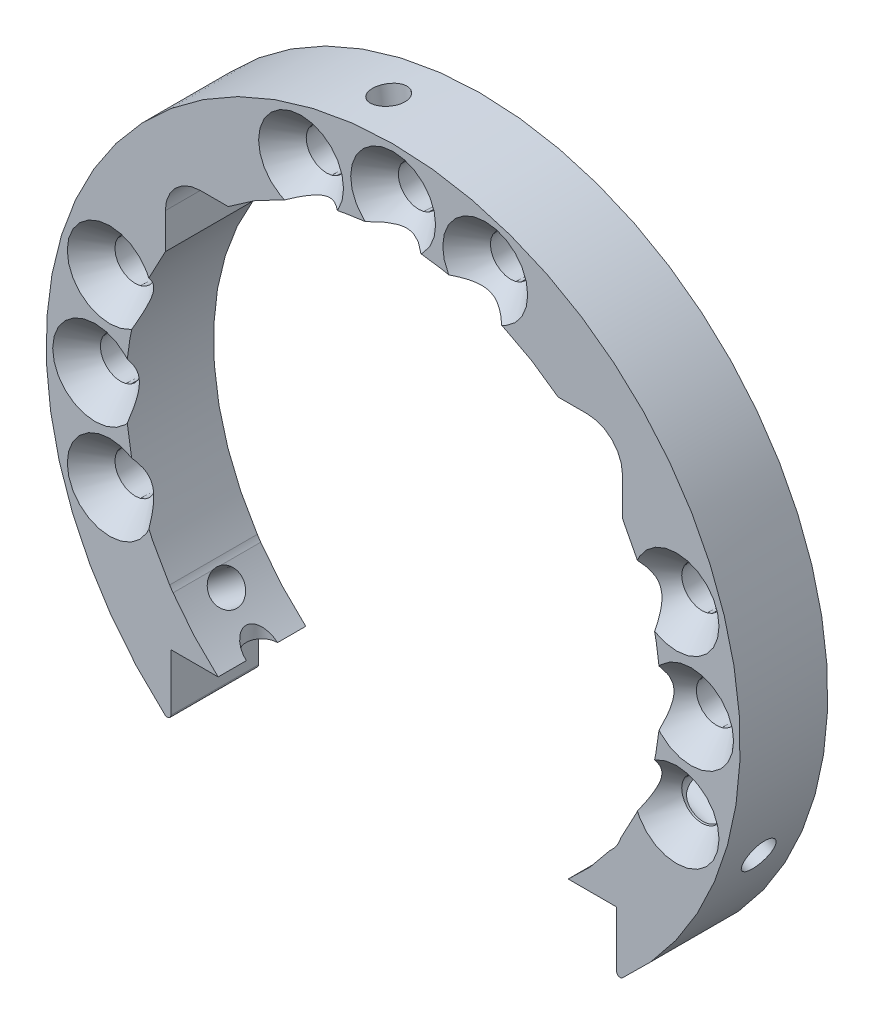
SolidWorks part; units mm, degrees
ref_plane "Front Plane" through (0, 0, 0) normal (0, 0, 1) x (1, 0, 0)
ref_plane "Top Plane" through (0, 0, 0) normal (0, 1, 0) x (1, 0, 0)
ref_plane "Right Plane" through (0, 0, 0) normal (1, 0, 0) x (0, 0, -1)
sketch "Sketch1" plane through (0, 0, 0) normal (0, 0, 1) x (1, 0, 0)
  line L0 (0, 0) -> (-25.146, 0) construction
  line L1 (0, 0) -> (12.573, 21.7771) construction
  line L2 (0, 0) -> (12.573, -21.7771) construction
  circle A0 centre (0, 0) radius 25.146
  dimension "D1" = 50.292
  dimension "D2" = 120
  dimension "D3" = 120
extrude "Boss-Extrude1" add sketch "Sketch1" along normal blind 6.35
sketch "Sketch2" plane through (0, 0, 6.35) normal (0, 0, 1) x (1, 0, 0)
  line L1 (-24.9185, -14.6395) -> (24.0391, -14.6395)
  line L2 (-24.9185, -14.6395) -> (-24.9185, -26.8241)
  line L3 (-24.9185, -26.8241) -> (24.0391, -26.8241)
  line L4 (24.0391, -14.6395) -> (24.0391, -26.8241)
extrude "Cut-Extrude1" cut sketch "Sketch2" against normal blind 4.7625
sketch "Sketch3" plane through (0, 0, 6.35) normal (0, 0, 1) x (1, 0, 0)
  line L1 (29.7951, -26.5733) -> (19.05, -26.5733)
  line L2 (29.7951, -26.5733) -> (29.7951, 23.8125)
  line L3 (29.7951, 23.8125) -> (19.05, 23.8125)
  line L4 (19.05, -26.5733) -> (19.05, 23.8125)
  dimension "D1" = 19.05
extrude "Cut-Extrude3" cut sketch "Sketch3" against normal blind 4.7625
sketch "Sketch5" plane through (0, 0, 6.35) normal (0, 0, 1) x (1, 0, 0)
  line L0 (16.1942, -14.6395) -> (16.1942, -19.2372)
  line L1 (19.05, -14.6395) -> (-20.4452, -14.6395) construction
  line L2 (19.05, -14.6395) -> (20.4452, -14.6395)
  line L3 (16.1942, -14.6395) -> (19.05, -14.6395)
  line L4 (-16.1067, -14.6395) -> (-16.1067, -19.3105)
  line L5 (-20.4452, -14.6395) -> (-16.1067, -14.6395)
  circle A0 centre (0, 0) radius 25.146 construction
  arc A1 (16.1942, -19.2372) -> (20.4452, -14.6395) centre (0, 0) ccw
  arc A2 (-16.1067, -19.3105) -> (-20.4452, -14.6395) centre (0, 0) cw
extrude "Boss-Extrude2" add sketch "Sketch5" against normal blind 4.7625
hole_wizard "#4-40 Tapped Hole1" positions "Sketch6" profile "Sketch7" tap size "#4-40" standard "ANSI Inch"
sketch "Sketch6" plane through (0, -14.6395, 0) normal (0, -1, 0) x (-1, 0, 0)
  line L0 (-16.1942, 0) -> (16.1067, 0) construction
  point P0 (12.7, -3.175)
  point P2 (-12.7, -3.175)
  dimension "D1" = 25.4
  dimension "D2" = 12.7
  dimension "D3" = 3.175
sketch "Sketch7" plane through (-12.7, -14.6395, 3.175) normal (1, 0, 0) x (0, 0, -1)
  line L0 (0, 0) -> (0, 6.7752)
  line L1 (0, 6.7752) -> (1.1303, 6.096)
  line L2 (1.1303, 6.096) -> (1.1303, 0)
  line L5 (1.1303, 0) -> (0, 0)
  line L10 (0, 6.7752) -> (-1.1303, 6.096) construction
  line L11 (0, -6.35) -> (0, 107.95) construction
  dimension "Tap Drill Dia." = 2.2606
  dimension "Tap Drill Depth" = 6.096
  dimension "Drill Angle" = 118
sketch "Sketch8" plane through (0, 0, 6.35) normal (0, 0, 1) x (1, 0, 0)
  line L0 (16.6168, 11.9363) -> (16.6168, 15.4391)
  line L3 (-19.2876, -11.9363) -> (16.6168, -11.9363)
  line L4 (16.6168, 11.9363) -> (16.6168, -11.9363)
  circle A0 centre (0, 0) radius 22.6823 construction
  arc A2 (16.6168, 15.4391) -> (-19.2876, -11.9363) centre (0, 0) ccw
  point P0 (0, 0)
extrude "Cut-Extrude4" cut sketch "Sketch8" against normal blind 6.35
sketch "Sketch9" plane through (0, 0, 6.35) normal (0, 0, 1) x (1, 0, 0)
  line L0 (-14.0723, 17.7892) -> (14.0723, 17.7892)
  circle A0 centre (0, 0) radius 22.6823 construction
  arc A1 (14.0723, 17.7892) -> (-14.0723, 17.7892) centre (0, 0) ccw
extrude "Boss-Extrude3" add sketch "Sketch9" against normal blind 6.35 separate body
combine bodies "Combine1" operation type add bodies to combine 106 107
sketch "Sketch12" plane through (0, 0, 6.35) normal (0, 0, 1) x (1, 0, 0)
  line L0 (19.05, 16.414) -> (19.05, -14.6395) construction
  line L1 (19.05, 16.414) -> (18.1261, 16.414)
  line L2 (18.1261, 16.414) -> (18.1261, -15.0455)
  line L3 (18.1261, -15.0455) -> (20.1483, -15.0455)
  arc A0 (19.05, 16.414) -> (20.1483, -15.0455) centre (0, 0) cw
extrude "Boss-Extrude4" add sketch "Sketch12" against normal up to surface (6.35 mm away)
mirror "Mirror1" about plane through (0, 0, 0) normal (1, 0, 0) of "Boss-Extrude4"
sketch "Sketch13" plane through (0, 0, 6.35) normal (0, 0, 1) x (1, 0, 0)
  line L0 (-16.51, 16.3128) -> (-16.51, -12.6861)
  line L2 (-16.51, -12.6861) -> (-19.239, -12.6541)
  line L3 (-19.239, -12.6541) -> (-19.239, 13.8267)
  line L4 (-19.239, 13.8267) -> (-16.51, 16.3128)
  dimension "D1" = 16.51
extrude "Boss-Extrude7" add sketch "Sketch13" against normal up to surface (6.35 mm away) contours L3 L4 L0 L2
ref_plane "Plane1" through (16.6168, -11.9363, 6.35) normal (1, 0, 0) x (0, 0, -1)
sketch "Sketch14" plane through (0, 0, 6.35) normal (0, 0, 1) x (1, 0, 0)
  line L0 (-17.8389, 15.24) -> (17.6266, 15.24)
  line L1 (17.6266, 15.24) -> (15.248, 17.2787)
  line L2 (15.248, 17.2787) -> (13.7912, 18.6451)
  line L3 (13.7912, 18.6451) -> (-12.9382, 18.6451)
  line L4 (-12.9382, 18.6451) -> (-16.0975, 17.0228)
  line L5 (-16.0975, 17.0228) -> (-17.8389, 15.24)
  dimension "D1" = 15.24
extrude "Boss-Extrude8" add sketch "Sketch14" against normal up to surface (6.35 mm away)
sketch "Sketch16" plane through (0, 0, 6.35) normal (0, 0, 1) x (1, 0, 0)
  line L1 (-16.51, 20.7015) -> (16.51, 20.7015)
  line L2 (-16.51, 20.7015) -> (-16.51, -12.3185)
  line L3 (-16.51, -12.3185) -> (16.51, -12.3185)
  line L4 (16.51, 20.7015) -> (16.51, -12.3185)
  line L5 (-16.51, 20.7015) -> (16.51, -12.3185) construction
  line L6 (-16.51, -12.3185) -> (16.51, 20.7015) construction
  point P0 (0, 4.1915)
  dimension "D1" = 33.02
  dimension "D2" = 33.02
hole_wizard "CSK for #4 Flat Head Machine Screw (100)1" positions "Sketch10" profile "Sketch11" countersink size "#4" standard "ANSI Inch"
sketch "Sketch10" plane through (0, 0, 6.35) normal (0, 0, 1) x (1, 0, 0)
  point P0 (0, 21.59)
  dimension "D1" = 21.59
sketch "Sketch11" plane through (0, 21.59, 6.35) normal (1, 0, 0) x (0, -1, 0)
  line L0 (0, 0) -> (0, 26.2852)
  line L1 (0, 26.2852) -> (1.4732, 25.4)
  line L2 (1.4732, 25.4) -> (1.4732, 1.8465)
  line L3 (1.4732, 1.8465) -> (3.0783, 0)
  line L5 (3.0783, 0) -> (0, 0)
  line L6 (-1.4732, 1.8465) -> (-3.0783, 0) construction
  line L10 (0, 26.2852) -> (-1.4732, 25.4) construction
  line L11 (0, -6.35) -> (0, 107.95) construction
  dimension "Hole Dia." = 2.9464
  dimension "Hole Depth" = 25.4
  dimension "Near C'Sink Dia." = 6.1566
  dimension "Near C'Sink Angle" = 82
  dimension "Drill Angle" = 118
pattern_circular "CirPattern1" count 4 over 360 about axis through (0, 0, 0) along (0, 0, 1) of "CSK for #4 Flat Head Machine Screw (100)1"
pattern_circular "CirPattern2" count 2 every 18 about axis through (0, 0, 0) along (0, 0, 1) of "CirPattern1", "CSK for #4 Flat Head Machine Screw (100)1"
pattern_circular "CirPattern3" count 2 every 18 about axis through (0, 0, 0) along (0, 0, 1) of "CirPattern1", "CSK for #4 Flat Head Machine Screw (100)1"
fillet "Fillet7" radius 2.54 4 edges at (-16.51, -11.9363, 3.175) (16.6168, -11.9363, 3.175) (16.6168, 15.24, 3.175) (-16.51, 15.24, 3.175)
sketch "Sketch18" plane through (0, 0, 1.5875) normal (0, 0, 1) x (1, 0, 0)
  line L1 (-16.1067, -14.6395) -> (16.1942, -14.6395)
  line L2 (-16.1067, -14.6395) -> (-16.1067, -26.8579)
  line L3 (-16.1067, -26.8579) -> (16.1942, -26.8579)
  line L4 (16.1942, -14.6395) -> (16.1942, -26.8579)
extrude "Cut-Extrude5" cut sketch "Sketch18" against normal through all
fillet "Fillet2" radius 0.254 2 edges at (16.1942, -19.2372, 3.175) (-16.1067, -19.3105, 3.175)
ref_plane "Plane3" through (0, 0, 3.175) normal (0, 0, 1) x (1, 0, 0)
sketch "Sketch21" plane through (0, 0, 3.175) normal (0, 0, 1) x (1, 0, 0)
  line L0 (0, 0) -> (-3.9715, 28.2587)
  line L1 (0, 0) -> (0, 30.0835) construction
  dimension "D1" = 8
ref_plane "Plane2" through (-3.9715, 28.2587, 3.175) normal (-0.1392, 0.9903, 0) x (0.9903, 0.1392, 0)
hole_wizard "#4-48 Tapped Hole1" positions "Sketch19" profile "Sketch20" tap size "#4-48" standard "ANSI Inch"
sketch "Sketch19" plane through (-3.9715, 28.2587, 3.175) normal (-0.1392, 0.9903, 0) x (0.9903, 0.1392, 0)
  point P0 (0, 0)
  dimension "D1" = 3.175
sketch "Sketch20" plane through (-3.9715, 28.2587, 3.175) normal (0, 0, 1) x (-0.9903, -0.1392, 0)
  line L0 (0, 0) -> (0, 19.7635)
  line L1 (0, 19.7635) -> (1.1874, 19.05)
  line L2 (1.1874, 19.05) -> (1.1874, 0)
  line L5 (1.1874, 0) -> (0, 0)
  line L10 (0, 19.7635) -> (-1.1875, 19.05) construction
  line L11 (0, -6.35) -> (0, 107.95) construction
  dimension "Tap Drill Dia." = 2.3749
  dimension "Tap Drill Depth" = 19.05
  dimension "Drill Angle" = 118
pattern_circular "CirPattern4" count 3 over 360 about axis through (0, 0, 6.35) along (0, 0, -1) of "#4-48 Tapped Hole1"
sketch "Sketch22" plane through (0, 0, 6.35) normal (0, 0, 1) x (1, 0, 0)
  circle A0 centre (0, 0) radius 19.3675
  dimension "D1" = 38.735
extrude "Cut-Extrude6" cut sketch "Sketch22" against normal through all
